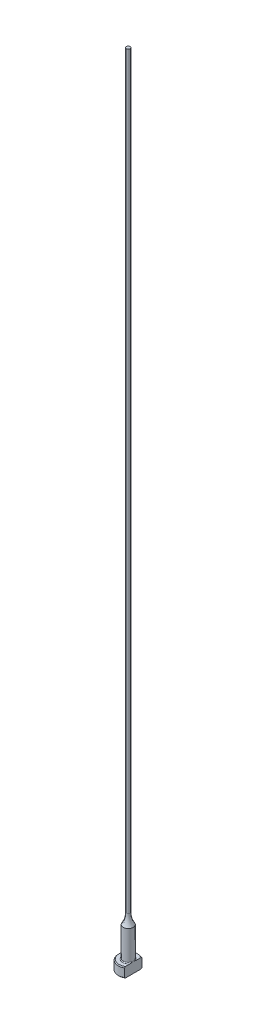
SolidWorks part; units mm, degrees
ref_plane "Front Plane" through (0, 0, 0) normal (0, 0, 1) x (1, 0, 0)
ref_plane "Top Plane" through (0, 0, 0) normal (0, 1, 0) x (1, 0, 0)
ref_plane "Right Plane" through (0, 0, 0) normal (1, 0, 0) x (0, 0, -1)
sketch "Sketch1" plane through (0, 0, 0) normal (0, 0, 1) x (1, 0, 0)
  line L0 (0, 259.9588) -> (0, -15.1925) construction
  line L1 (0, 0) -> (-3.175, 0)
  line L2 (-3.175, 0) -> (-3.175, 3.175)
  line L3 (-3.175, 3.175) -> (-1.5875, 3.175)
  line L4 (-0.5944, 16.1098) -> (-0.5944, 254)
  line L5 (-0.5944, 254) -> (0, 254)
  line L6 (0, 254) -> (0, 0)
  line L7 (-1.5875, 3.175) -> (-1.5875, 12.7)
  arc A0 (-1.5875, 12.7) -> (-0.5944, 16.1098) centre (-6.9444, 16.1098) ccw
  point P13 (-1.5875, 0)
  dimension "D1" = 6.35
  dimension "L" = 254
  dimension "D2" = 3.175
  dimension "H" = 6.35
  dimension "T" = 3.175
  dimension "D" = 1.1887
  dimension "S" = 12.7
revolve "Revolve1" add sketch "Sketch1" angle 360 about L0
chamfer "Chamfer1" distance 0.254 angle 45 2 edges at (0, 3.175, 3.175) (0, 0, 3.175)
fillet "Fillet1" radius 0.254 1 edges at (0, 3.175, 1.5875)
sketch "Sketch2" plane through (0, 0, 0) normal (0, 1, 0) x (1, 0, 0)
  line L0 (1.5875, -2.7496) -> (1.5875, 2.7496)
  circle A0 centre (0, 0) radius 3.175 construction
  arc A2 (1.5875, -2.7496) -> (1.5875, 2.7496) centre (0, 0) ccw
  circle A3 centre (0, 0) radius 3.175 construction
  circle A4 centre (0, 0) radius 1.5875 construction
extrude "Key Head" cut sketch "Sketch2" along normal up to next
